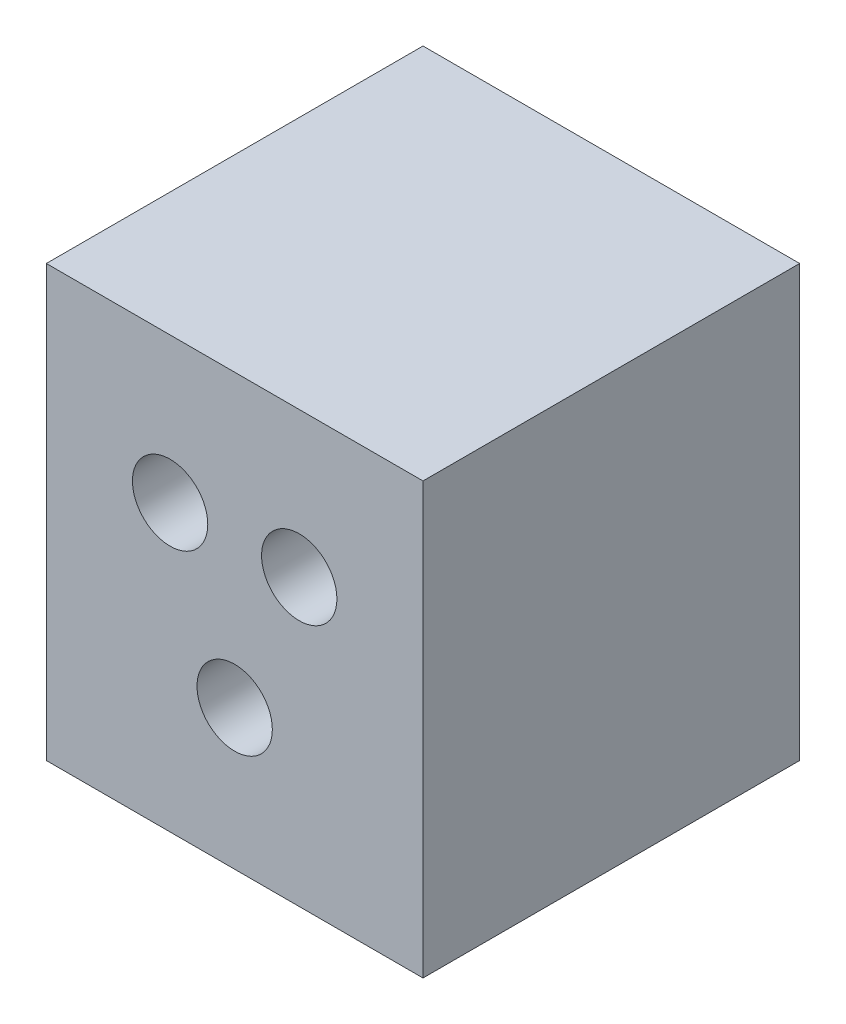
SolidWorks part; units mm, degrees
ref_plane "Plan de face" through (0, 0, 0) normal (0, 0, 1) x (1, 0, 0)
ref_plane "Plan de dessus" through (0, 0, 0) normal (0, 1, 0) x (1, 0, 0)
ref_plane "Plan de droite" through (0, 0, 0) normal (1, 0, 0) x (0, 0, -1)
sketch "Esquisse1" plane through (0, 0, 0) normal (0, 0, 1) x (1, 0, 0)
  line L1 (0, 0) -> (35, 0)
  line L2 (0, 0) -> (0, 40)
  line L3 (0, 40) -> (35, 40)
  line L4 (35, 0) -> (35, 40)
  dimension "D1" = 40
  dimension "D2" = 35
extrude "Extrusion1" add sketch "Esquisse1" along normal blind 35
hole_wizard "Trou taraudé M8x1.01" positions "Esquisse3" profile "Esquisse2" tap size "M8x1.0" standard "ISO"
sketch "Esquisse3" plane through (0, 0, 35) normal (0, 0, 1) x (1, 0, 0)
  line L0 (0, 0) -> (35, 0) construction
  line L1 (35, 0) -> (35, 40) construction
  point P0 (11.5, 26.5)
  point P1 (23.5, 26.5)
  point P3 (17.5, 13)
  dimension "D1" = 13
  dimension "D2" = 17.5
  dimension "D3" = 13.5
  dimension "D4" = 13.5
  dimension "D5" = 12
  dimension "D6" = 6
sketch "Esquisse2" plane through (11.5, 26.5, 35) normal (1, 0, 0) x (0, -1, 0)
  line L0 (0, 0) -> (0, 21.103)
  line L1 (0, 21.103) -> (3.5, 19)
  line L2 (3.5, 19) -> (3.5, 0)
  line L5 (3.5, 0) -> (0, 0)
  line L10 (0, 21.103) -> (-3.5, 19) construction
  line L11 (0, -6.35) -> (0, 107.95) construction
  dimension "Diamètre du trou pour taraudage" = 7
  dimension "Profondeur du trou pour taraudage" = 19
  dimension "Angle de pointe" = 118
